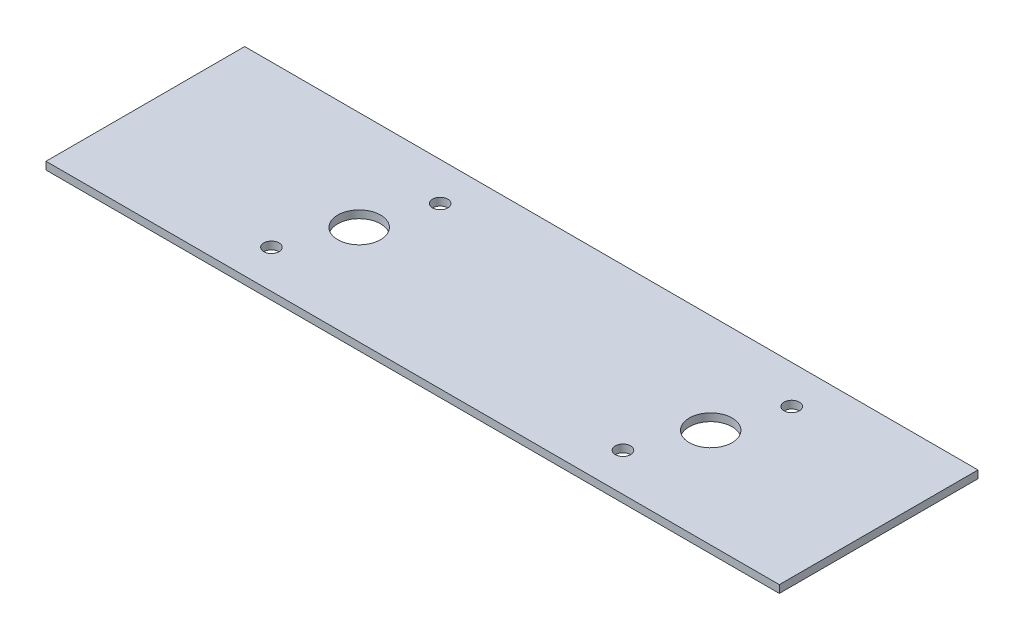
SolidWorks part; units mm, degrees
ref_plane "Front Plane" through (0, 0, 0) normal (0, 0, 1) x (1, 0, 0)
ref_plane "Top Plane" through (0, 0, 0) normal (0, 1, 0) x (1, 0, 0)
ref_plane "Right Plane" through (0, 0, 0) normal (1, 0, 0) x (0, 0, -1)
sketch "Sketch1" plane through (0, 402.2121, 0) normal (0, 1, 0) x (1, 0, 0)
  line L0 (-912.2029, -1338.6392) -> (-607.5404, -1338.6392)
  line L1 (-607.5404, -1338.6392) -> (-607.5404, -1256.0892)
  line L2 (-607.5404, -702.6158) -> (-607.5404, -1338.6392) construction
  line L3 (-607.5404, -1256.0892) -> (-912.2029, -1256.0892)
  line L4 (-912.2029, -1338.6392) -> (-912.2029, -702.6158) construction
  line L5 (-912.2029, -1256.0892) -> (-912.2029, -1338.6392)
  dimension "D1" = 82.55
extrude "Boss-Extrude1" add sketch "Sketch1" along normal blind 3.175
sketch "Sketch2" plane through (0, 405.3871, 0) normal (0, 1, 0) x (1, 0, 0)
  line L0 (-759.8716, -1256.0892) -> (-759.8716, -1338.6392) construction
  line L3 (-912.2029, -1297.3642) -> (-607.5404, -1297.3642) construction
  line L4 (-912.2029, -1256.0892) -> (-912.2029, -1338.6392) construction
  line L5 (-607.5404, -1338.6392) -> (-607.5404, -1256.0892) construction
  line L6 (-607.5404, -1256.0892) -> (-912.2029, -1256.0892) construction
  line L7 (-912.2029, -1338.6392) -> (-607.5404, -1338.6392) construction
  line L8 (-740.8216, -1256.0892) -> (-740.8216, -1338.6392) construction
  circle A0 centre (-823.3716, -1297.3642) radius 8.89
  circle A1 centre (-677.3216, -1297.3642) radius 8.89
  dimension "D1" = 17.78
  dimension "D2" = 17.78
  dimension "D4" = 63.5
  dimension "D3" = 82.55
  dimension "D5" = 19.05
extrude "Cut-Extrude1" cut sketch "Sketch2" against normal blind 3.175
sketch "Sketch3" plane through (0, 402.2121, 0) normal (0, -1, 0) x (1, 0, 0)
  circle A0 centre (-834.4186, 1322.7642) radius 3.175
  circle A1 centre (-815.1186, 1271.9642) radius 3.175
  circle A2 centre (-688.3686, 1322.7642) radius 3.175
  circle A3 centre (-669.0686, 1271.9642) radius 3.175
  dimension "D1" = 6.35
extrude "Cut-Extrude2" cut sketch "Sketch3" against normal blind 12.7
